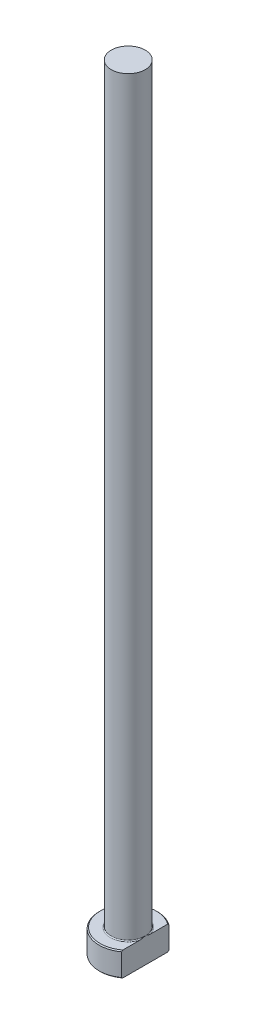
SolidWorks part; units mm, degrees
ref_plane "Front Plane" through (0, 0, 0) normal (0, 0, 1) x (1, 0, 0)
ref_plane "Top Plane" through (0, 0, 0) normal (0, 1, 0) x (1, 0, 0)
ref_plane "Right Plane" through (0, 0, 0) normal (1, 0, 0) x (0, 0, -1)
sketch "Sketch1" plane through (0, 0, 0) normal (0, 0, 1) x (1, 0, 0)
  line L0 (0, 259.9588) -> (0, -15.1925) construction
  line L1 (0, 0) -> (-6, 0)
  line L2 (-6, 0) -> (-6, 5)
  line L3 (-6, 5) -> (-3.5, 5)
  line L4 (-3.5, 5) -> (-3.5, 160)
  line L5 (-3.5, 160) -> (0, 160)
  line L6 (0, 160) -> (0, 0)
  dimension "L" = 160
  dimension "H" = 12
  dimension "T" = 5
  dimension "D" = 7
revolve "Revolve1" add sketch "Sketch1" angle 360 about L0
chamfer "Chamfer1" distance 0.2 angle 45 2 edges at (0, 5, 6) (0, 0, 6)
fillet "Fillet1" radius 0.2 1 edges at (0, 5, 3.5)
sketch "Sketch2" plane through (0, 0, 0) normal (0, 1, 0) x (1, 0, 0)
  line L0 (3.5, 4.8734) -> (3.5, -4.8734)
  circle A0 centre (0, 0) radius 6 construction
  arc A1 (3.5, -4.8734) -> (3.5, 4.8734) centre (0, 0) ccw
  circle A2 centre (0, 0) radius 3.5 construction
extrude "KEY" cut sketch "Sketch2" along normal through all
